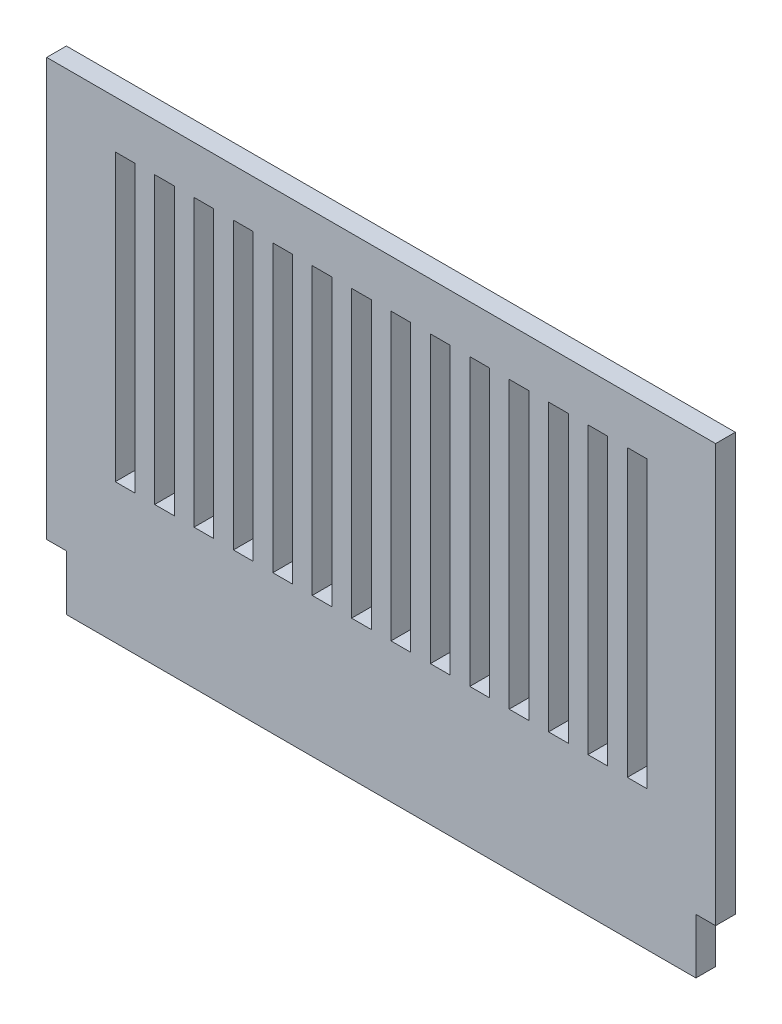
SolidWorks part; units mm, degrees
ref_plane "Front Plane" through (0, 0, 0) normal (0, 0, 1) x (1, 0, 0)
ref_plane "Top Plane" through (0, 0, 0) normal (0, 1, 0) x (1, 0, 0)
ref_plane "Right Plane" through (0, 0, 0) normal (1, 0, 0) x (0, 0, -1)
sketch "Sketch1" plane through (0, 0, 0) normal (0, 0, 1) x (1, 0, 0)
  line L0 (-3.175, 68.58) -> (104.6629, 68.58)
  line L1 (104.6629, 68.58) -> (104.6629, 1.27)
  line L2 (104.6629, 1.27) -> (101.4879, 1.27)
  line L3 (101.4879, 1.27) -> (101.4879, -7.62)
  line L4 (101.4879, -7.62) -> (0, -7.62)
  line L5 (0, -7.62) -> (0, 1.27)
  line L6 (0, 1.27) -> (-3.175, 1.27)
  line L7 (-3.175, 1.27) -> (-3.175, 68.58)
  line L8 (52.3315, 14.8615) -> (52.3315, 60.9116)
  line L9 (55.5065, 14.8615) -> (55.5065, 60.9116)
  line L10 (58.6815, 14.8615) -> (58.6815, 60.9116)
  line L11 (61.8565, 14.8615) -> (61.8565, 60.9116)
  line L12 (65.0315, 14.8615) -> (65.0315, 60.9116)
  line L13 (68.2065, 14.8615) -> (68.2065, 60.9116)
  line L14 (71.3815, 14.8615) -> (71.3815, 60.9116)
  line L15 (74.5565, 14.8615) -> (74.5565, 60.9116)
  line L16 (77.7315, 14.8615) -> (77.7315, 60.9116)
  line L17 (80.9065, 14.8615) -> (80.9065, 60.9116)
  line L18 (84.0815, 14.8615) -> (84.0815, 60.9116)
  line L19 (87.2565, 14.8615) -> (87.2565, 60.9116)
  line L20 (90.4315, 14.8615) -> (90.4315, 60.9116)
  line L21 (93.6065, 14.8615) -> (93.6065, 60.9116)
  line L22 (52.3315, 14.8615) -> (55.5065, 14.8615)
  line L23 (52.3315, 60.9116) -> (55.5065, 60.9116)
  line L24 (58.6815, 60.9116) -> (61.8565, 60.9116)
  line L25 (58.6815, 14.8615) -> (61.8565, 14.8615)
  line L26 (65.0315, 60.9116) -> (68.2065, 60.9116)
  line L27 (65.0315, 14.8615) -> (68.2065, 14.8615)
  line L28 (71.3815, 60.9116) -> (74.5565, 60.9116)
  line L29 (77.7315, 60.9116) -> (80.9065, 60.9116)
  line L30 (84.0815, 60.9116) -> (87.2565, 60.9116)
  line L31 (90.4315, 60.9116) -> (93.6065, 60.9116)
  line L32 (71.3815, 14.8615) -> (74.5565, 14.8615)
  line L33 (77.7315, 14.8615) -> (80.9065, 14.8615)
  line L34 (84.0815, 14.8615) -> (87.2565, 14.8615)
  line L35 (90.4315, 14.8615) -> (93.6065, 14.8615)
  line L36 (11.0565, 14.8615) -> (7.8815, 14.8615)
  line L37 (17.4065, 14.8615) -> (14.2315, 14.8615)
  line L38 (23.7565, 14.8615) -> (20.5815, 14.8615)
  line L39 (30.1065, 14.8615) -> (26.9315, 14.8615)
  line L40 (11.0565, 60.9116) -> (7.8815, 60.9116)
  line L41 (17.4065, 60.9116) -> (14.2315, 60.9116)
  line L42 (23.7565, 60.9116) -> (20.5815, 60.9116)
  line L43 (30.1065, 60.9116) -> (26.9315, 60.9116)
  line L44 (36.4565, 14.8615) -> (33.2815, 14.8615)
  line L45 (36.4565, 60.9116) -> (33.2815, 60.9116)
  line L46 (42.8065, 14.8615) -> (39.6315, 14.8615)
  line L47 (42.8065, 60.9116) -> (39.6315, 60.9116)
  line L48 (49.1565, 60.9116) -> (45.9815, 60.9116)
  line L49 (49.1565, 14.8615) -> (45.9815, 14.8615)
  line L50 (7.8815, 14.8615) -> (7.8815, 60.9116)
  line L51 (11.0565, 14.8615) -> (11.0565, 60.9116)
  line L52 (14.2315, 14.8615) -> (14.2315, 60.9116)
  line L53 (17.4065, 14.8615) -> (17.4065, 60.9116)
  line L54 (20.5815, 14.8615) -> (20.5815, 60.9116)
  line L55 (23.7565, 14.8615) -> (23.7565, 60.9116)
  line L56 (26.9315, 14.8615) -> (26.9315, 60.9116)
  line L57 (30.1065, 14.8615) -> (30.1065, 60.9116)
  line L58 (33.2815, 14.8615) -> (33.2815, 60.9116)
  line L59 (36.4565, 14.8615) -> (36.4565, 60.9116)
  line L60 (39.6315, 14.8615) -> (39.6315, 60.9116)
  line L61 (42.8065, 14.8615) -> (42.8065, 60.9116)
  line L62 (45.9815, 14.8615) -> (45.9815, 60.9116)
  line L63 (49.1565, 14.8615) -> (49.1565, 60.9116)
extrude "Boss-Extrude1" add sketch "Sketch1" along normal blind 3.175
